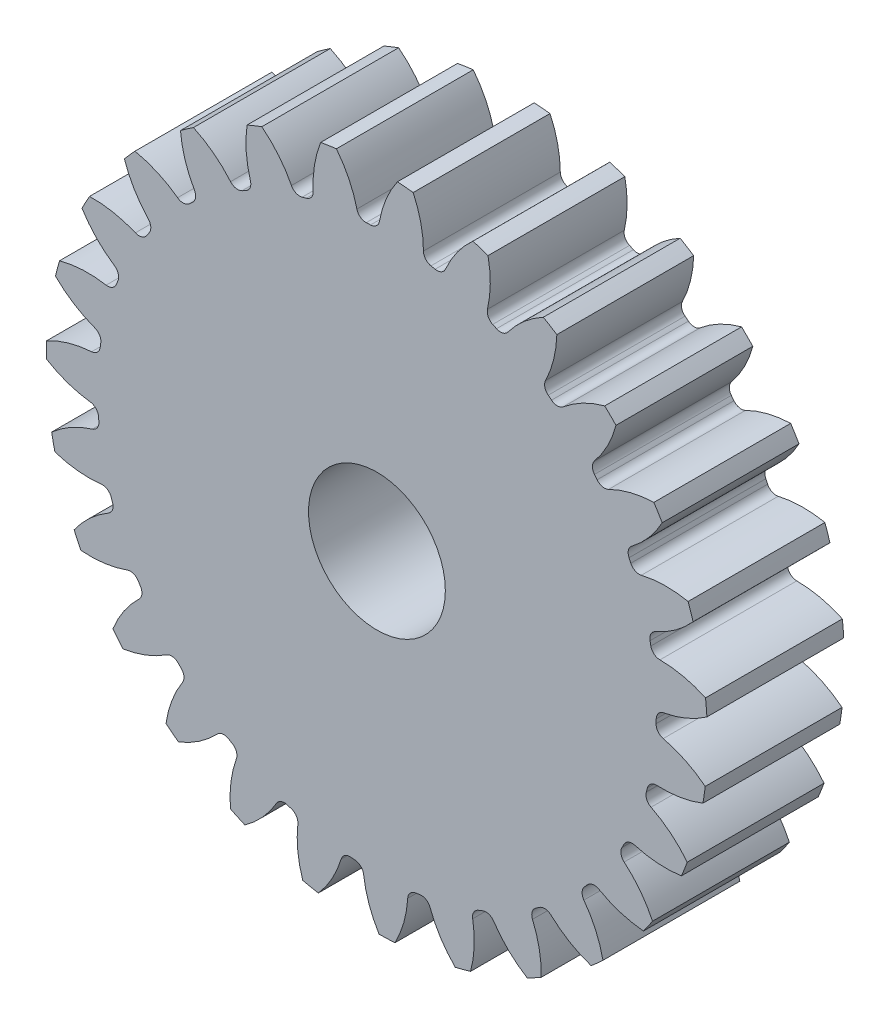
SolidWorks part; units mm, degrees
ref_plane "Front" through (0, 0, 0) normal (0, 0, 1) x (1, 0, 0)
ref_plane "Top" through (0, 0, 0) normal (0, 1, 0) x (1, 0, 0)
ref_plane "Right" through (0, 0, 0) normal (1, 0, 0) x (0, 0, -1)
sketch "Sketch3" plane through (0, 0, 0) normal (0, 0, 1) x (1, 0, 0)
  circle A0 centre (0, 0) radius 245.5333
  dimension "od" = 491.0667
extrude "gearBody" add sketch "Sketch3" along normal blind 101.6
sketch "Sketch2" plane through (0, 0, 0) normal (0, 0, 1) x (1, 0, 0)
  line L0 (0, 0) -> (198.462, 82.2057) construction
  line L1 (244.2596, -29.7882) -> (0, 0) construction
  line L2 (0, 0) -> (36.3143, 0) construction
  line L3 (228.4949, 6.9304) -> (227.7617, -19.5592) construction
  line L5 (228.1283, -6.3144) -> (0, 0) construction
  line L7 (0, 0) -> (214.8137, 0) construction
  arc A0 (214.7952, 2.8232) -> (214.3101, -14.7005) centre (0, 0) ccw construction
  arc A1 (245.0201, 15.868) -> (243.7672, -29.3972) centre (0, 0) ccw construction
  arc A2 (228.4949, 6.9304) -> (227.7617, -19.5592) centre (0, 0) ccw construction
  arc A3 (207.3041, -7.3198) -> (207.3916, -4.1586) centre (0, 0) ccw
  arc A4 (244.2596, -29.7882) -> (212.5787, -14.2635) centre (193.6109, -93.0579) ccw
  arc A5 (244.2596, -29.7882) -> (245.5333, 16.2312) centre (0, 0) ccw
  arc A6 (245.5333, 16.2312) -> (213.0423, 2.4827) centre (198.462, 82.2057) cw
  arc A7 (207.3916, -4.1586) -> (213.0423, 2.4827) centre (214.2821, -4.2968) cw
  arc A8 (212.5787, -14.2635) -> (207.3041, -7.3198) centre (214.1917, -7.563) cw
  point P6 (245.5333, 16.2312)
  point P22 (244.2596, -29.7882)
  dimension "baseDia" = 429.6275
  dimension "od" = 491.0667
  dimension "pd" = 457.2
  dimension "rd" = 414.8667
  dimension "rFillet" = 6.8919
  dimension "pointX" = 245.5333
  dimension "pointY" = 16.2312
  dimension "CTT" = 26.4896
  dimension "flankCenterAngle" = 22.5
extrude "toothCut" cut sketch "Sketch2" along normal through all
pattern_circular "CirPattern1" count 27 over 360 about axis through (0, 0, 0) along (0, 0, 1) of "toothCut"
sketch "hub1Dia" plane through (0, 0, 0) normal (0, 0, -1) x (-1, 0, 0)
  circle A0 centre (0, 0) radius 12.7
  dimension "hub1Dia" = 25.4
sketch "hub2Dia" plane through (0, 0, 101.6) normal (0, 0, 1) x (1, 0, 0)
  circle A0 centre (0, 0) radius 12.7
  dimension "hub2dia" = 25.4
sketch "boreDia" plane through (0, 0, 0) normal (0, 0, 1) x (1, 0, 0)
  circle A0 centre (0, 0) radius 50.8
  dimension "boreDia" = 101.6
extrude "bore" cut sketch "boreDia" against normal mid plane 25400
